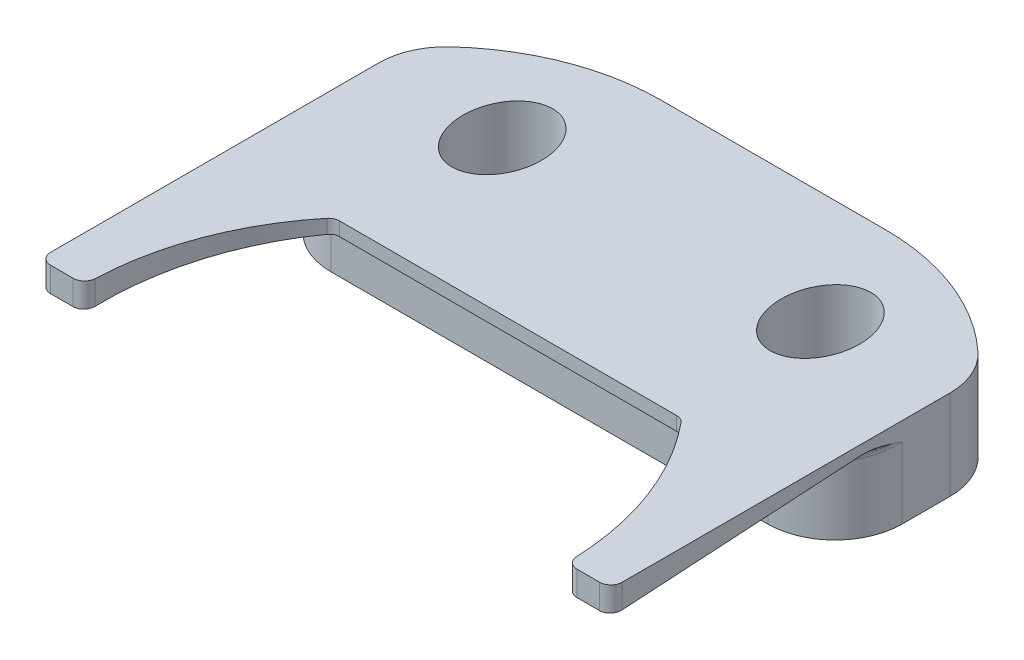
SolidWorks part; units mm, degrees
ref_plane "Front Plane" through (0, 0, 0) normal (0, 0, 1) x (1, 0, 0)
ref_plane "Top Plane" through (0, 0, 0) normal (0, 1, 0) x (1, 0, 0)
ref_plane "Right Plane" through (0, 0, 0) normal (1, 0, 0) x (0, 0, -1)
sketch "Sketch1" plane through (0, 0, 0) normal (0, 1, 0) x (1, 0, 0)
  line L0 (0, 5) -> (0, -5) construction
  line L1 (12.75, -5) -> (-12.75, -5)
  line L2 (12.75, -5) -> (12.75, 1.3196)
  line L3 (5, 5) -> (-5, 5)
  line L4 (-12.75, -5) -> (-12.75, 1.3196)
  line L5 (12.75, -5) -> (-12.75, 5) construction
  line L6 (12.75, 5) -> (-12.75, -5) construction
  line L7 (-7.1, 0) -> (-7.1, -5) construction
  line L8 (-7.1, -5) -> (-5, -5) construction
  line L9 (12.75, 1.3196) -> (12.75, 5) construction
  line L10 (12.75, 5) -> (5, 5) construction
  line L11 (-12.75, 1.3196) -> (-12.75, 5) construction
  line L12 (-12.75, 5) -> (-5, 5) construction
  arc A0 (-12.75, 1.3196) -> (-5, 5) centre (-5, -5) cw
  arc A1 (12.75, 1.3196) -> (5, 5) centre (5, -5) ccw
  ellipse E0 centre (-7.1, 0) end of major axis (-7.1, 2.25) minor radius 1.75
  ellipse E1 centre (7.1, 0) end of major axis (7.1, -2.25) minor radius 1.75
  point P0 (0, 0)
  dimension "D8" = 10
  dimension "D1" = 25.5
  dimension "D2" = 10
  dimension "D3" = 3.5
  dimension "D4" = 4.5
  dimension "D5" = 3.9
  dimension "D6" = 5
  dimension "D7" = 2.1
extrude "Boss-Extrude1" add sketch "Sketch1" along normal blind 4
sketch "Sketch2" plane through (12.75, 0, 0) normal (1, 0, 0) x (0, 0, -1)
  line L3 (-5, 4) -> (-15, 4)
  line L4 (-15, 4) -> (-15, 2.9)
  line L5 (-15, 2.9) -> (-5, 3.5)
  line L6 (-5, 4) -> (-5, 0) construction
  line L7 (-5, 3.5) -> (-5, 4)
  dimension "D1" = 1.1
  dimension "D2" = 0.5
  dimension "D3" = 10
extrude "Boss-Extrude2" add sketch "Sketch2" against normal up to surface (25.5 mm away)
sketch "Sketch3" plane through (0, 4, 0) normal (0, 1, 0) x (1, 0, 0)
  line L0 (-12.75, -6.8402) -> (12.75, -6.8402) construction
  line L1 (-12.75, 1.3196) -> (-12.75, -15) construction
  line L2 (12.75, -15) -> (12.75, 1.3196) construction
  line L3 (0, -6.8402) -> (0, 0) construction
  line L4 (10.75, -15) -> (-10.75, -15)
  line L5 (-12.75, -15) -> (12.75, -15) construction
  line L6 (-7.75, -6.8402) -> (7.75, -6.8402)
  arc A0 (-10.75, -15) -> (-7.75, -6.8402) centre (1.8471, -15) cw
  arc A1 (10.75, -15) -> (7.75, -6.8402) centre (-1.8471, -15) ccw
  point P16 (0, -15)
  dimension "D2" = 5
  dimension "D1" = 2
extrude "Cut-Extrude1" cut sketch "Sketch3" against normal through all
fillet "Fillet1" radius 3 4 edges at (12.75, 1.75, 5) (-12.75, 1.75, 5) (12.75, 2, -1.3196) (-12.75, 2, -1.3196)
fillet "Fillet2" radius 0.5 9 edges at (7.75, 3.6948, 6.8402) (-7.75, 3.6948, 6.8402) (-12.75, 3.45, 15) (12.75, 3.45, 15) (10.75, 3.45, 15) (-10.75, 3.45, 15) (11.8713, 3.5527, 4.1213) (-11.8713, 3.5527, 4.1213) (0, 3.5, 5)
